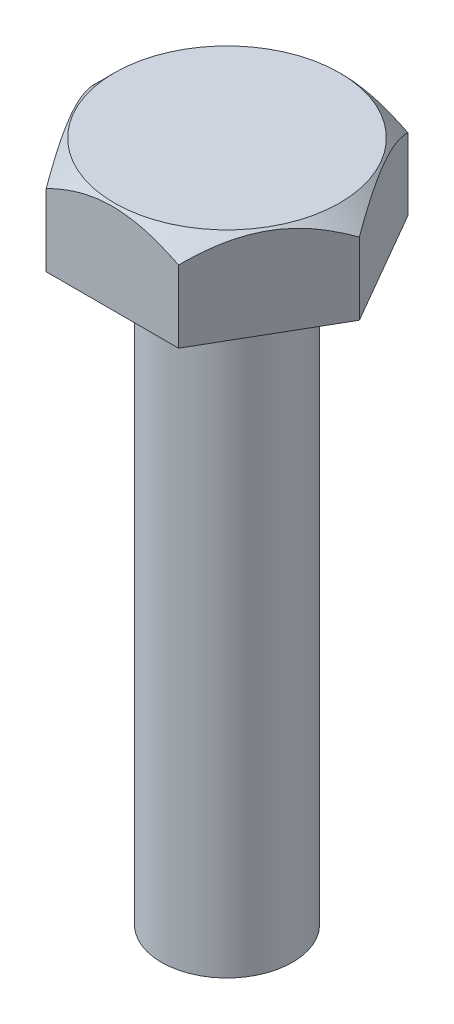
SolidWorks part; units mm, degrees
ref_plane "Aufriss" through (0, 0, 0) normal (0, 0, 1) x (1, 0, 0)
ref_plane "Grundriss" through (0, 0, 0) normal (0, 1, 0) x (1, 0, 0)
ref_plane "Seitenriss" through (0, 0, 0) normal (1, 0, 0) x (0, 0, -1)
sketch "Skizze2" plane through (0, 0, 0) normal (0, 1, 0) x (1, 0, 0)
  circle A0 centre (0, 0) radius 2
  dimension "D1" = 4
extrude "Aufsatz-Linear austragen1" add sketch "Skizze2" along normal blind 18
sketch "Skizze3" plane through (0, 18, 0) normal (0, 1, 0) x (1, 0, 0)
  line L1 (2.0207, 3.5) -> (-2.0207, 3.5)
  line L2 (-2.0207, 3.5) -> (-4.0415, 0)
  line L3 (-4.0415, 0) -> (-2.0207, -3.5)
  line L4 (-2.0207, -3.5) -> (2.0207, -3.5)
  line L5 (2.0207, -3.5) -> (4.0415, 0)
  line L6 (4.0415, 0) -> (2.0207, 3.5)
  circle A0 centre (0, 0) radius 3.5 construction
  dimension "D1" = 7
extrude "Aufsatz-Linear austragen2" add sketch "Skizze3" along normal blind 2.8
sketch "Skizze4" plane through (0, 0, 0) normal (0, 0, 1) x (1, 0, 0)
  line L0 (-4.0415, 20.8) -> (-4.0415, 20.2)
  line L1 (-4.0415, 20.8) -> (-4.0415, 18) construction
  line L2 (-4.0415, 20.2) -> (-3.4415, 20.8)
  line L3 (-4.0415, 20.8) -> (-2.0207, 20.8) construction
  line L4 (-3.4415, 20.8) -> (-4.0415, 20.8)
  line L5 (0, 0) -> (0, 7.3301) construction
  dimension "D1" = 0.6
revolve "Schnitt-Rotation1" cut sketch "Skizze4" angle 360 about L5
